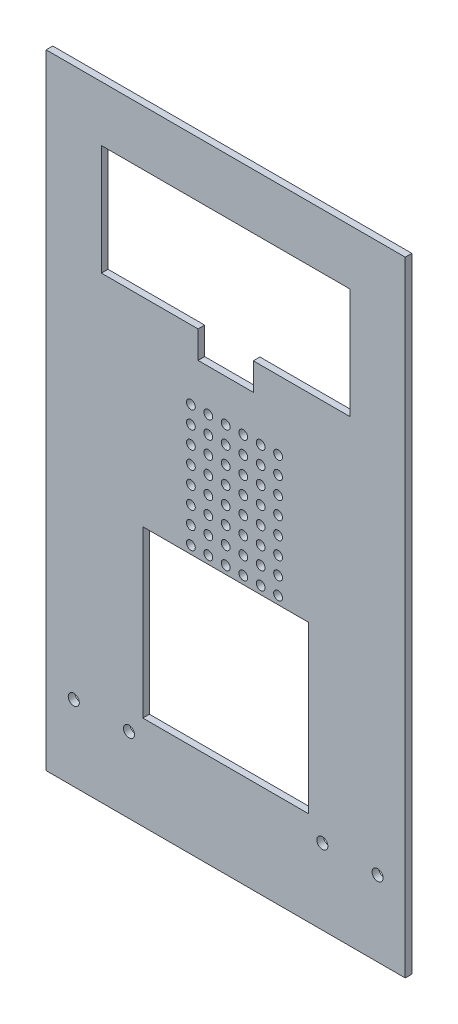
SolidWorks part; units mm, degrees
ref_plane "Front Plane" through (0, 0, 0) normal (0, 0, 1) x (1, 0, 0)
ref_plane "Top Plane" through (0, 0, 0) normal (0, 1, 0) x (1, 0, 0)
ref_plane "Right Plane" through (0, 0, 0) normal (1, 0, 0) x (0, 0, -1)
sketch "Sketch1" plane through (0, 0, 0) normal (0, 0, 1) x (1, 0, 0)
  line L1 (-82.55, 146.05) -> (82.55, 146.05)
  line L2 (-82.55, 146.05) -> (-82.55, -146.05)
  line L3 (-82.55, -146.05) -> (82.55, -146.05)
  line L4 (82.55, 146.05) -> (82.55, -146.05)
  line L5 (-82.55, 146.05) -> (82.55, -146.05) construction
  line L6 (-82.55, -146.05) -> (82.55, 146.05) construction
  point P0 (0, 0)
  dimension "D1" = 165.1
  dimension "D2" = 292.1
extrude "Boss-Extrude1" add sketch "Sketch1" along normal blind 3.048
sketch "Sketch2" plane through (0, 0, 0) normal (0, 0, 1) x (1, 0, 0)
  line L1 (-82.55, -146.05) -> (82.55, -146.05) construction
  line L2 (-82.55, -146.05) -> (82.55, -146.05) construction
  line L3 (8.0869, 109.0549) -> (-8.0869, 109.0549)
  line L4 (8.0869, 109.0549) -> (8.0869, 76.3651)
  line L5 (8.0869, 76.3651) -> (-8.0869, 76.3651)
  line L6 (-8.0869, 109.0549) -> (-8.0869, 76.3651)
  line L7 (8.0869, 109.0549) -> (-8.0869, 76.3651) construction
  line L8 (8.0869, 76.3651) -> (-8.0869, 109.0549) construction
  line L9 (-38.1, -21.59) -> (38.1, -21.59)
  line L10 (-38.1, -21.59) -> (-38.1, -97.79)
  line L11 (-38.1, -97.79) -> (38.1, -97.79)
  line L12 (38.1, -21.59) -> (38.1, -97.79)
  line L13 (-38.1, -21.59) -> (38.1, -97.79) construction
  line L14 (-38.1, -97.79) -> (38.1, -21.59) construction
  circle A1 centre (0, 92.71) radius 10.7315
  circle A2 centre (0, 38.1) radius 2.0193
  circle A3 centre (0, 30.1) radius 2.0193
  circle A4 centre (0, 22.1) radius 2.0193
  circle A5 centre (0, 14.1) radius 2.0193
  circle A6 centre (0, 6.1) radius 2.0193
  circle A7 centre (0, -1.9) radius 2.0193
  circle A8 centre (0, -9.9) radius 2.0193
  circle A9 centre (0, -17.9) radius 2.0193
  circle A10 centre (-8, 38.1) radius 2.0193
  circle A11 centre (-16, 38.1) radius 2.0193
  circle A12 centre (-8, 30.1) radius 2.0193
  circle A13 centre (-16, 30.1) radius 2.0193
  circle A14 centre (-8, 22.1) radius 2.0193
  circle A15 centre (-16, 22.1) radius 2.0193
  circle A16 centre (-8, 14.1) radius 2.0193
  circle A17 centre (-16, 14.1) radius 2.0193
  circle A18 centre (-8, 6.1) radius 2.0193
  circle A19 centre (-16, 6.1) radius 2.0193
  circle A20 centre (-8, -1.9) radius 2.0193
  circle A21 centre (-16, -1.9) radius 2.0193
  circle A22 centre (-8, -9.9) radius 2.0193
  circle A23 centre (-16, -9.9) radius 2.0193
  circle A24 centre (-8, -17.9) radius 2.0193
  circle A25 centre (-16, -17.9) radius 2.0193
  circle A26 centre (24.0869, 14.1) radius 2.0193
  circle A27 centre (8.0869, 14.1) radius 2.0193
  circle A28 centre (8.0869, -17.9) radius 2.0193
  circle A29 centre (24.0869, 6.1) radius 2.0193
  circle A30 centre (16.0869, 6.1) radius 2.0193
  circle A31 centre (8.0869, -1.9) radius 2.0193
  circle A32 centre (8.0869, 30.1) radius 2.0193
  circle A33 centre (24.0869, 22.1) radius 2.0193
  circle A34 centre (24.0869, -1.9) radius 2.0193
  circle A35 centre (24.0869, -9.9) radius 2.0193
  circle A36 centre (8.0869, 6.1) radius 2.0193
  circle A37 centre (16.0869, 22.1) radius 2.0193
  circle A38 centre (8.0869, 22.1) radius 2.0193
  circle A39 centre (8.0869, -9.9) radius 2.0193
  circle A40 centre (24.0869, -17.9) radius 2.0193
  circle A41 centre (16.0869, 14.1) radius 2.0193
  circle A42 centre (16.0869, -17.9) radius 2.0193
  circle A43 centre (16.0869, 30.1) radius 2.0193
  circle A44 centre (24.0869, 30.1) radius 2.0193
  circle A45 centre (16.0869, -9.9) radius 2.0193
  circle A46 centre (16.0869, -1.9) radius 2.0193
  circle A47 centre (16.0869, 38.1) radius 2.0193
  circle A48 centre (8.0869, 38.1) radius 2.0193
  circle A49 centre (24.0869, 38.1) radius 2.0193
  point P2 (0, -59.69)
  dimension "D3" = 21.463
  dimension "D5" = 4.0386
  dimension "D7" = 184.15
  dimension "D2" = 86.36
  dimension "D4" = 152.4
  dimension "D8" = 16.1738
  dimension "D9" = 32.6898
  dimension "D11" = 76.2
  dimension "D12" = 76.2
  dimension "D6" = 3
  dimension "D10" = 8
extrude "Cut-Extrude1" cut sketch "Sketch2" along normal through all contours A13 | A19 | A18 | A20 | A24 | A39 | A31
sketch "Sketch4" plane through (0, 0, 0) normal (0, 0, 1) x (1, 0, 0)
  line L0 (-12.7, 57.3108) -> (-12.7, 69.85)
  line L1 (57.15, 120.65) -> (-57.15, 120.65)
  line L2 (57.15, 120.65) -> (57.15, 69.85)
  line L4 (-57.15, 120.65) -> (-57.15, 69.85)
  line L7 (-12.7, 57.3108) -> (12.7, 57.3108)
  line L9 (12.7, 57.3108) -> (12.7, 69.85)
  line L10 (-57.15, 69.85) -> (-12.7, 69.85)
  line L11 (12.7, 69.85) -> (57.15, 69.85)
  line L12 (82.55, 146.05) -> (-82.55, 146.05) construction
  circle A0 centre (0, -1.9) radius 2.0193 construction
  point P5 (0, 146.05)
  point P11 (0, 0)
  point P12 (0, 120.65)
  dimension "D1" = 12.5392
  dimension "D2" = 114.3
  dimension "D3" = 25.4
  dimension "D4" = 25.4
  dimension "D6" = 59.2108
extrude "Cut-Extrude2" cut sketch "Sketch4" along normal through all
sketch "Sketch5" plane through (0, 0, 0) normal (0, 0, -1) x (-1, 0, 0)
  line L0 (82.55, -146.05) -> (-82.55, -146.05) construction
  line L1 (-82.55, -146.05) -> (-82.55, 146.05) construction
  line L2 (0, 1.6764) -> (0, -1.6764) construction
  circle A0 centre (-44.45, -106.299) radius 2.54
  circle A2 centre (-69.85, -106.299) radius 2.54
  circle A3 centre (69.85, -106.299) radius 2.54
  circle A4 centre (44.45, -106.299) radius 2.54
  dimension "D1" = 5.08
  dimension "D2" = 39.751
  dimension "D3" = 25.4
  dimension "D4" = 12.7
extrude "Cut-Extrude3" cut sketch "Sketch5" against normal through all
sketch "Sketch6" plane through (0, 0, 0) normal (0, 0, -1) x (-1, 0, 0)
  line L0 (82.55, 146.05) -> (82.55, -146.05) construction
  line L1 (-82.55, -146.05) -> (82.55, -146.05)
  line L2 (-82.55, -146.05) -> (-82.55, -140.97)
  line L3 (-82.55, -140.97) -> (82.55, -140.97)
  line L4 (82.55, -146.05) -> (82.55, -140.97)
  dimension "D1" = 5.08
extrude "Cut-Extrude4" cut sketch "Sketch6" against normal through all
equation "\"thickness_acrylic0.1\"=0.1in"
equation "\"motor offset\"=6mm"
equation "\"thickness0.25\"=0.225in"
equation "\"thickness0.125\"=0.122in"
